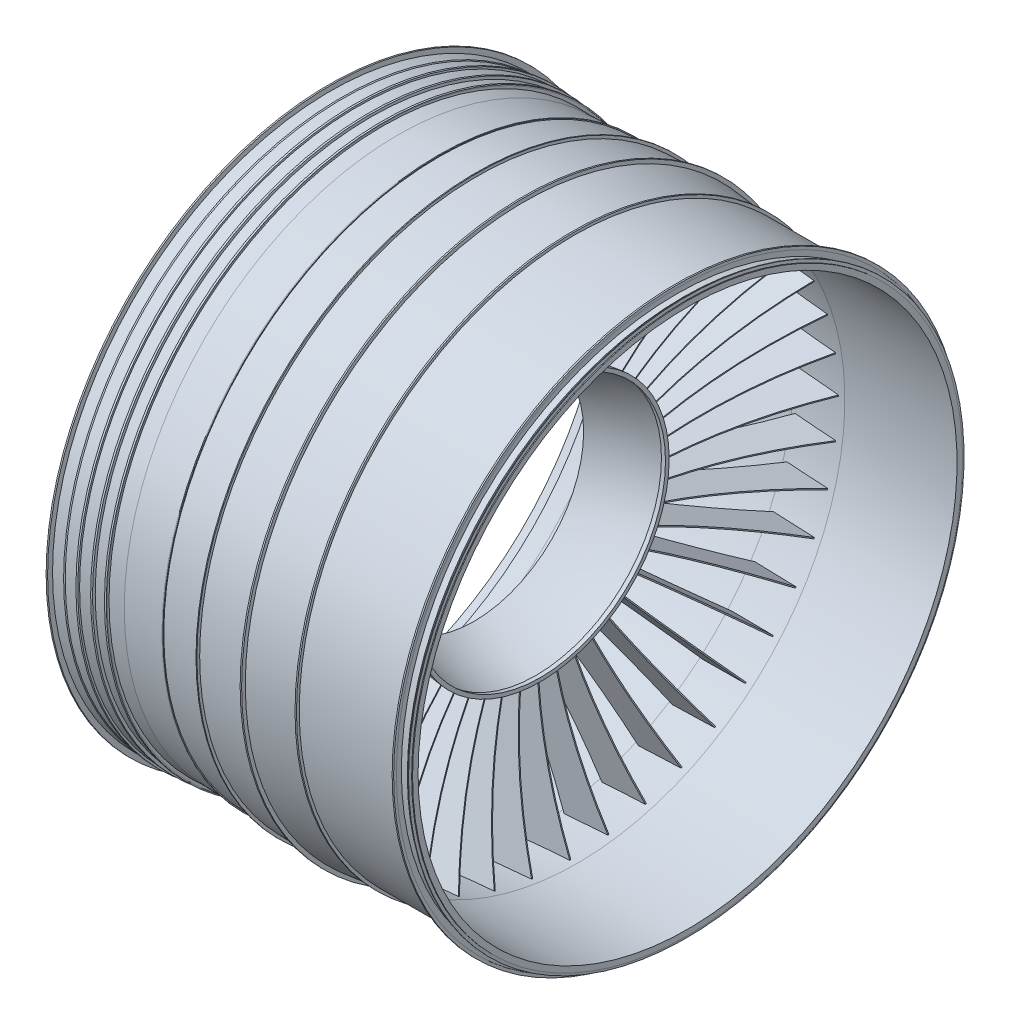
SolidWorks part; units mm, degrees
ref_plane "前视基准面" through (0, 0, 0) normal (0, 0, 1) x (1, 0, 0)
ref_plane "上视基准面" through (0, 0, 0) normal (0, 1, 0) x (1, 0, 0)
ref_plane "右视基准面" through (0, 0, 0) normal (1, 0, 0) x (0, 0, -1)
other "Configuration Table"
sketch "草图1" plane through (0, 0, 0) normal (0, 0, 1) x (1, 0, 0)
  line L0 (-8.7511, 1507) -> (61.2489, 1507)
  line L1 (61.2489, 1507) -> (61.2489, 1487)
  line L2 (61.2489, 1487) -> (51.2489, 1485)
  line L3 (51.2489, 1485) -> (51.2489, 1480)
  line L4 (51.2489, 1480) -> (141.2489, 1480)
  line L6 (141.2489, 1480) -> (341.2489, 1455)
  line L7 (341.2489, 1455) -> (1041.2489, 1480)
  line L8 (1041.2489, 1480) -> (1341.2489, 1455)
  line L9 (1341.2489, 1455) -> (1941.2489, 1465)
  line L10 (1941.2489, 1465) -> (1941.2489, 1495)
  line L16 (1876.2489, 1491) -> (1321.2489, 1491)
  line L17 (1321.2489, 1491) -> (1321.2489, 1506)
  line L19 (1313.2489, 1506) -> (1313.2489, 1491)
  line L21 (1053.2489, 1516.2904) -> (1053.2489, 1536.2904)
  line L22 (1053.2489, 1536.2904) -> (1045.2489, 1536.2904)
  line L23 (1045.2489, 1536.2904) -> (1045.2489, 1516.2904)
  line L25 (1045.2489, 1516.2904) -> (795.2489, 1506.2904)
  line L26 (795.2489, 1506.2904) -> (795.2489, 1521.2904)
  line L27 (795.2489, 1521.2904) -> (790.2489, 1521.2904)
  line L28 (790.2489, 1521.2904) -> (790.2489, 1506.2904)
  line L30 (590.2489, 1496.2904) -> (590.2489, 1501.2904)
  line L31 (590.2489, 1501.2904) -> (585.2489, 1501.2904)
  line L32 (585.2489, 1501.2904) -> (585.2489, 1496.2904)
  line L34 (285.2489, 1489) -> (285.2489, 1504)
  line L35 (285.2489, 1504) -> (290.2489, 1504)
  line L36 (290.2489, 1504) -> (290.2489, 1509)
  line L37 (290.2489, 1509) -> (280.2489, 1509)
  line L38 (280.2489, 1509) -> (280.2489, 1489)
  line L40 (220.2489, 1499) -> (220.2489, 1514)
  line L41 (220.2489, 1514) -> (210.2489, 1514)
  line L42 (210.2489, 1514) -> (210.2489, 1509)
  line L43 (210.2489, 1509) -> (215.2489, 1509)
  line L44 (215.2489, 1509) -> (215.2489, 1499)
  line L46 (145.2489, 1509) -> (145.2489, 1519)
  line L47 (145.2489, 1519) -> (135.2489, 1519)
  line L48 (135.2489, 1519) -> (135.2489, 1509)
  line L50 (65.2489, 1507) -> (59.2489, 1510)
  line L51 (59.2489, 1510) -> (-0.7511, 1510)
  line L52 (-0.7511, 1510) -> (-0.7511, 1537)
  line L53 (-0.7511, 1537) -> (-8.7511, 1537)
  line L54 (-8.7511, 1537) -> (-8.7511, 1507)
  line L55 (65.2489, 1507) -> (135.2489, 1509)
  line L56 (145.2489, 1509) -> (215.2489, 1499)
  line L57 (220.2489, 1499) -> (280.2489, 1489)
  line L58 (285.2489, 1489) -> (365.2489, 1486.2904)
  line L59 (365.2489, 1486.2904) -> (585.2489, 1496.2904)
  line L60 (590.2489, 1496.2904) -> (790.2489, 1506.2904)
  line L61 (1053.2489, 1516.2904) -> (1313.2489, 1491)
  line L62 (1313.2489, 1506) -> (1321.2489, 1506)
  line L63 (1876.2489, 1491) -> (1876.2489, 1541)
  line L64 (1876.2489, 1541) -> (1884.2489, 1541)
  line L65 (1884.2489, 1541) -> (1884.2489, 1526)
  line L66 (1884.2489, 1526) -> (1881.2489, 1526)
  line L67 (1881.2489, 1526) -> (1881.2489, 1496)
  line L68 (1881.2489, 1496) -> (1916.2489, 1496)
  line L69 (1916.2489, 1496) -> (1918.7489, 1501)
  line L70 (1918.7489, 1501) -> (1921.2489, 1495)
  line L71 (1921.2489, 1495) -> (1929.2489, 1495)
  line L72 (1929.2489, 1495) -> (1931.2489, 1510)
  line L73 (1931.2489, 1510) -> (1934.2489, 1510)
  line L74 (1934.2489, 1510) -> (1936.2489, 1495)
  line L75 (1936.2489, 1495) -> (1941.2489, 1495)
  line L76 (0, 0) -> (270.732, 0) construction
  point P61 (1881.2489, 1511)
  dimension "D1" = 20
  dimension "D2" = 10
  dimension "D3" = 5
  dimension "D4" = 90
  dimension "D5" = 200
  dimension "D6" = 25
  dimension "D7" = 70
  dimension "D8" = 30
  dimension "D9" = 3
  dimension "D10" = 8
  dimension "D11" = 60
  dimension "D12" = 70
  dimension "D13" = 2
  dimension "D14" = 10
  dimension "D15" = 10
  dimension "D16" = 10
  dimension "D17" = 70
  dimension "D18" = 60
  dimension "D19" = 5
  dimension "D20" = 15
  dimension "D21" = 20
  dimension "D22" = 15
  dimension "D23" = 5
  dimension "D24" = 10
  dimension "D25" = 5
  dimension "D26" = 10
  dimension "D27" = 5
  dimension "D28" = 4
  dimension "D29" = 10
  dimension "D30" = 10
  dimension "D31" = 3
  dimension "D32" = 2
  dimension "D33" = 80
  dimension "D34" = 250
  dimension "D35" = 10
  dimension "D36" = 5
  dimension "D37" = 5
  dimension "D38" = 5
  dimension "D39" = 700
  dimension "D40" = 25
  dimension "D41" = 200
  dimension "D42" = 10
  dimension "D43" = 15
  dimension "D44" = 5
  dimension "D45" = 15
  dimension "D46" = 300
  dimension "D47" = 10
  dimension "D48" = 20
  dimension "D49" = 8
  dimension "D50" = 20
  dimension "D51" = 300
  dimension "D52" = 25
  dimension "D53" = 260
  dimension "D54" = 15
  dimension "D55" = 8
  dimension "D56" = 15
  dimension "D57" = 600
  dimension "D58" = 50
  dimension "D59" = 8
  dimension "D60" = 5
  dimension "D61" = 15
  dimension "D62" = 30
  dimension "D63" = 35
  dimension "D64" = 5
  dimension "D65" = 2.5
  dimension "D66" = 1
  dimension "D67" = 2.5
  dimension "D68" = 8
  dimension "D69" = 15
  dimension "D70" = 15
  dimension "D71" = 2
  dimension "D72" = 2
  dimension "D73" = 3
  dimension "D74" = 5
  dimension "D75" = 10
  dimension "D76" = 1480
  dimension "D77" = 5
  dimension "D78" = 30
revolve "旋转1" add sketch "草图1" angle 360 about L76
sketch "草图2" plane through (0, 0, 0) normal (0, 0, 1) x (1, 0, 0)
  line L0 (1141.2489, 700) -> (1141.2489, 680)
  line L1 (1141.2489, 680) -> (1116.2489, 683)
  line L2 (1116.2489, 683) -> (1116.2489, 688)
  line L3 (781.2489, 595) -> (781.2489, 600)
  line L4 (1941.2489, -1495) -> (1941.2489, 1495) construction
  line L6 (1072.5, 0) -> (-1072.5, 0) construction
  spline S0 degree 3 poles (781.2489, 600) (845.9541, 631.207) (892.3404, 651.7213) (999.012, 678.2453) (1100.4891, 697.9434) (1141.2489, 700) knots 0 0 0 0 0.587845 0.687845 1 1 1 1
  spline S1 degree 2 poles (1116.2489, 688) (942.4759, 663.774) (781.2489, 595) knots 0 0 0 1 1 1
  point P7 (760.8825, 504.8952)
  point P9 (760.9794, 512.9213)
  point P14 (-35.8564, 765.6432)
  point P15 (575.6894, 672.5084)
  point P16 (575.6894, 683)
  point P17 (668.5163, 680)
  point P18 (735.8462, 681.2662)
  point P19 (1175.0826, 649.0524)
  point P20 (743.9256, 675.8621)
  point P21 (668.5163, 667.5185)
  point P22 (1206.4671, 667.7624)
  point P25 (1379.9829, 701.4784)
  dimension "D1" = 20
  dimension "D2" = 5
  dimension "D3" = 25
  dimension "D4" = 5
  dimension "D5" = 800
  dimension "D6" = 360
  dimension "D7" = 85
  dimension "D8" = 3
  dimension "D9" = 680
  dimension "D10" = 175
  dimension "D11" = 205
  dimension "D12" = 30
  dimension "D13" = 30
revolve "旋转2" add sketch "草图2" angle 360 about axis through (1045.2489, 0, 0) along (1, 0, 0)
sketch "草图3" plane through (0, 0, 0) normal (0, 0, 1) x (1, 0, 0)
  line L0 (1062.6206, 1478.219) -> (1303.966, 1458.1069)
  line L1 (1041.2489, 1480) -> (1341.2489, 1455) construction
  spline S0 degree 3 poles (821.6091, 619.1157) (864.5365, 639.1096) (958.1408, 672.6245) (1057.9028, 689.0751) (1129.747, 699.1749) knots 0 0 0 0 0.457546 1 1 1 1
  spline S1 degree 3 poles (781.2489, 600) (845.9541, 631.207) (892.3404, 651.7213) (999.012, 678.2453) (1100.4891, 697.9434) (1141.2489, 700) knots 0 0 0 0 0.587845 0.687845 1 1 1 1 construction
  spline S2 degree 2 poles (1062.6206, 1478.219) (991.7375, 1035.1281) (821.6091, 619.1157) knots 0 0 0 1 1 1
  spline S3 degree 2 poles (1129.747, 699.1749) (1156.2052, 1089.6764) (1303.966, 1458.1069) knots 0 0 0 1 1 1
  point P11 (0, 0)
  point P12 (966.2489, 670)
  point P13 (1129.747, 699.1749)
surface "曲面填充1" sketch "草图3"
thicken "加厚10" surfaces to thicken 108 thickness 3 thickness side both sides parameters "D1"=3
pattern_circular "阵列(圆周)2" count 44 over 360 about axis through (365.2489, 0, 0) along (-1, 0, 0)
